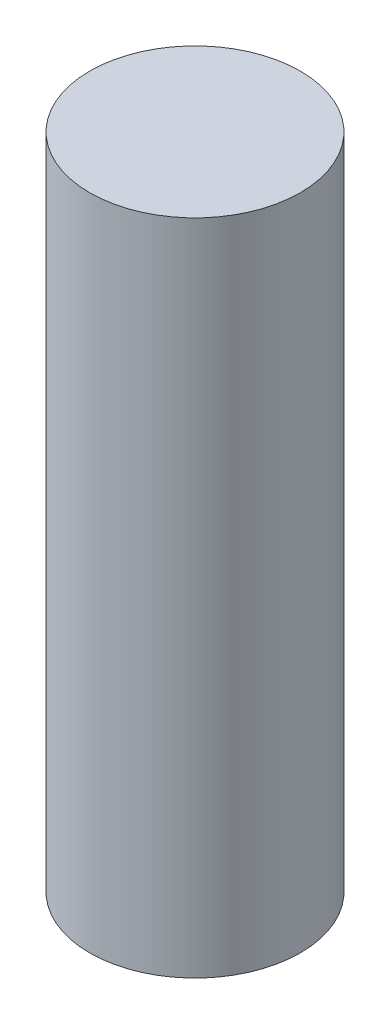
SolidWorks part; units mm, degrees
ref_plane "Front Plane" through (0, 0, 0) normal (0, 0, 1) x (1, 0, 0)
ref_plane "Top Plane" through (0, 0, 0) normal (0, 1, 0) x (1, 0, 0)
ref_plane "Right Plane" through (0, 0, 0) normal (1, 0, 0) x (0, 0, -1)
sketch "Sketch1" plane through (0, 0, 0) normal (0, 1, 0) x (1, 0, 0)
  circle A0 centre (0, 0) radius 4
  dimension "D1" = 8
extrude "Extrude1" add sketch "Sketch1" along normal blind 25
sketch "Sketch2" plane through (0, 25, 0) normal (0, 1, 0) x (-1, 0, 0)
  point P0 (0, -1.905)
  point P1 (0, 1.905)
  dimension "D1" = 1.905
  dimension "D2" = 3.81
